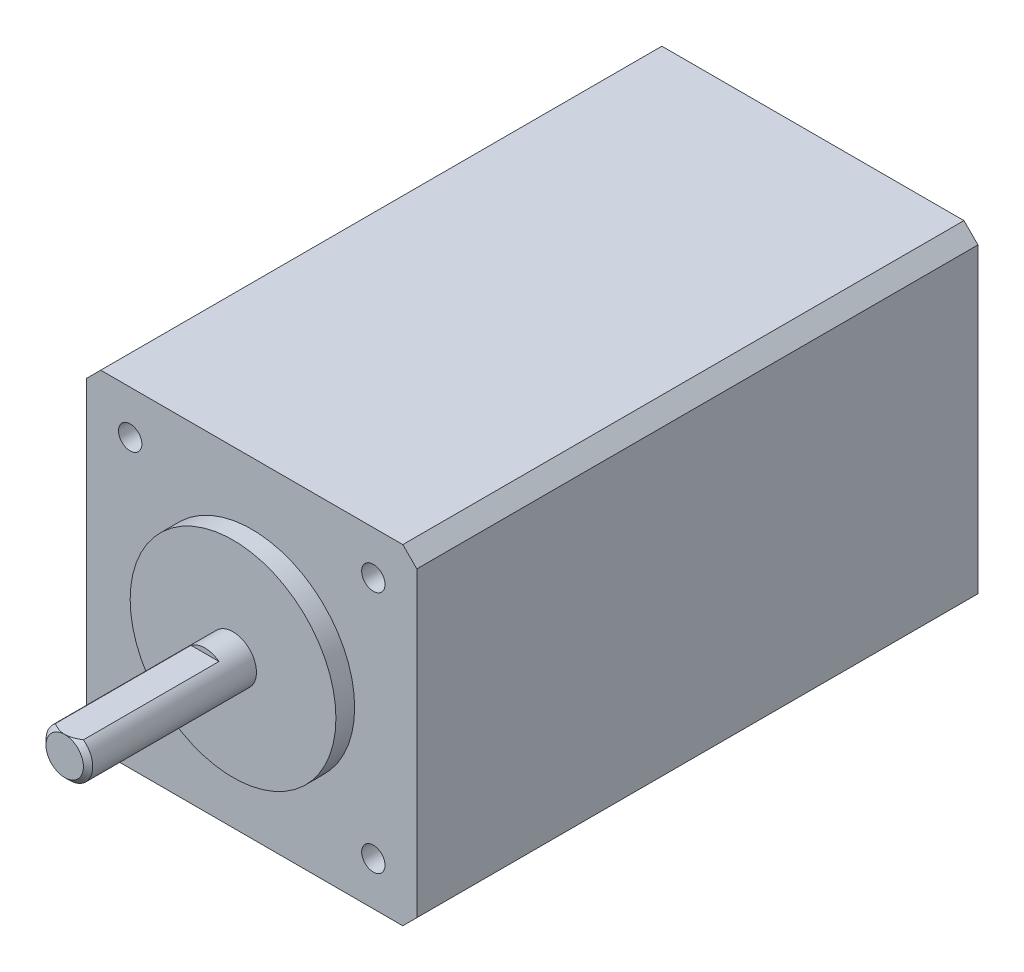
SolidWorks part; units mm, degrees
ref_plane "前视基准面" through (0, 0, 0) normal (0, 0, 1) x (1, 0, 0)
ref_plane "上视基准面" through (0, 0, 0) normal (0, 1, 0) x (1, 0, 0)
ref_plane "右视基准面" through (0, 0, 0) normal (1, 0, 0) x (0, 0, -1)
sketch "草图1" plane through (0, 0, 0) normal (0, 0, 1) x (1, 0, 0)
  circle A0 centre (0, 0) radius 11
extrude "凸台-拉伸1" add sketch "草图1" against normal blind 2
sketch "草图2" plane through (0, 0, 0) normal (0, 0, 1) x (1, 0, 0)
  circle A0 centre (0, 0) radius 2.5
extrude "凸台-拉伸2" add sketch "草图2" along normal blind 18
sketch "草图3" plane through (0, 0, 18) normal (0, 0, 1) x (1, 0, 0)
  line L1 (0, 2) -> (2.5, 2)
  line L2 (2.5, 2) -> (2.5, 3.5195)
  line L3 (2.5, 3.5195) -> (-3.2545, 3.5195)
  line L4 (-3.2545, 3.5195) -> (-3.2545, 2)
  line L5 (-3.2545, 2) -> (0, 2)
extrude "切除-拉伸1" cut sketch "草图3" against normal blind 15
sketch "草图4" plane through (0, 0, -2) normal (0, 0, -1) x (-1, 0, 0)
  line L0 (-17.65, 16.15) -> (-16.15, 17.65)
  line L1 (0, 17.65) -> (16.15, 17.65)
  line L2 (17.65, 16.15) -> (17.65, -16.15)
  line L3 (16.15, -17.65) -> (-16.15, -17.65)
  line L4 (-17.65, -16.15) -> (-17.65, 16.15)
  line L5 (-16.15, 17.65) -> (0, 17.65)
  line L6 (16.15, 17.65) -> (17.65, 16.15)
  line L7 (17.65, -16.15) -> (16.15, -17.65)
  line L8 (-16.15, -17.65) -> (-17.65, -16.15)
  point P3 (17.65, 17.65)
  point P4 (17.65, -17.65)
  point P5 (-17.65, -17.65)
  point P7 (-17.65, 17.65)
extrude "凸台-拉伸3" add sketch "草图4" along normal blind 60
sketch "草图5" plane through (0, 0, -2) normal (0, 0, 1) x (1, 0, 0)
  point P8 (-13, 13)
  point P9 (13, 13)
  point P10 (13, -13)
  point P11 (-13, -13)
hole_wizard "M3 螺纹孔1" positions "草图7" profile "草图6" tap size "M3" standard "GB"
sketch "草图7" plane through (0, 0, -2) normal (0, 0, 1) x (1, 0, 0)
  point P0 (-13, 13)
  point P3 (13, 13)
  point P6 (13, -13)
  point P9 (-13, -13)
sketch "草图6" plane through (-13, 13, -2) normal (1, 0, 0) x (0, -1, 0)
  line L0 (0, 0) -> (0, 5.7511)
  line L1 (0, 5.7511) -> (1.25, 5)
  line L2 (1.25, 5) -> (1.25, 0)
  line L5 (1.25, 0) -> (0, 0)
  line L10 (0, 5.7511) -> (-1.25, 5) construction
  line L11 (0, -6.35) -> (0, 107.95) construction
  dimension "螺纹孔钻头直径" = 2.5
  dimension "螺纹孔钻头深度" = 5
  dimension "导头角度" = 118
chamfer "倒角1" distance 0.5 angle 45 1 edges at (0, -2.5, 18)
